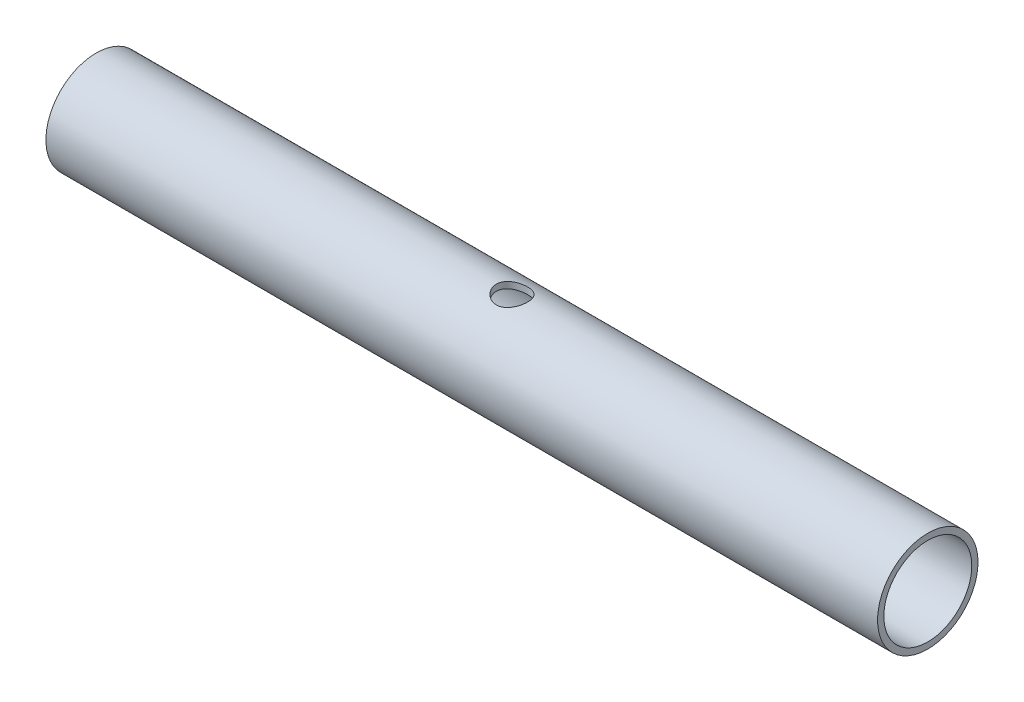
SolidWorks part; units mm, degrees
ref_plane "Anteriore" through (0, 0, 0) normal (0, 0, 1) x (1, 0, 0)
ref_plane "Superiore" through (0, 0, 0) normal (0, 1, 0) x (1, 0, 0)
ref_plane "Destro" through (0, 0, 0) normal (1, 0, 0) x (0, 0, -1)
sketch "Schizzo1" plane through (0, 0, 0) normal (0, 0, 1) x (1, 0, 0)
  line L0 (-200, 0) -> (200, 0)
  dimension "D1" = 400
other "Membro strutturale1"
ref_plane "Piano1" through (-200, 0, 0) normal (1, 0, 0) x (0, 0, -1)
sketch "Sketch1" plane through (-200, 0, 0) normal (1, 0, 0) x (0, 0, -1)
  circle A0 centre (0, 0) radius 21.15
  circle A1 centre (0, 0) radius 24.15
  point P3 (0, 0)
  dimension "Out_dia" = 48.3
  dimension "D1" = 3
sketch "Schizzo3" plane through (0, 0, 0) normal (0, 1, 0) x (1, 0, 0)
  circle A0 centre (0, 0) radius 7.5
  dimension "D1" = 15
extrude "Taglio-Estrusione1" cut sketch "Schizzo3" along normal through all
